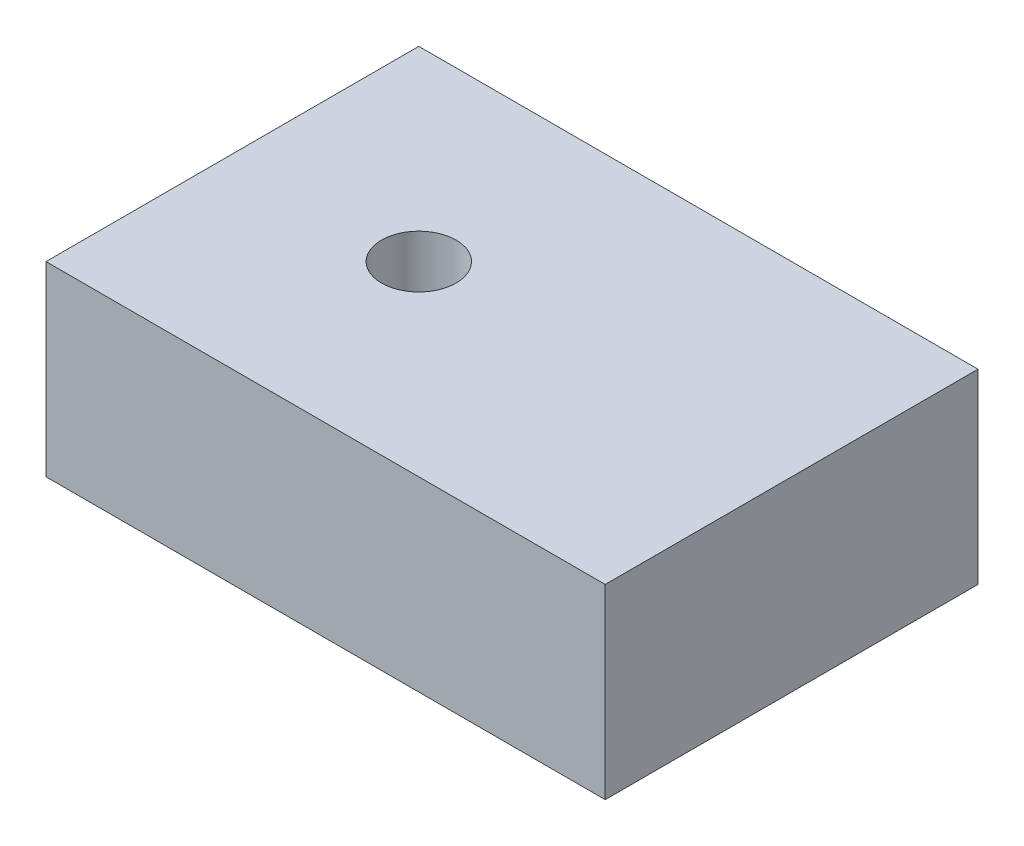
SolidWorks part; units mm, degrees
ref_plane "Vorne" through (0, 0, 0) normal (0, 0, 1) x (1, 0, 0)
ref_plane "Oben" through (0, 0, 0) normal (0, 1, 0) x (1, 0, 0)
ref_plane "Rechts" through (0, 0, 0) normal (1, 0, 0) x (0, 0, -1)
sketch "Skizze1" plane through (0, 0, 0) normal (0, 1, 0) x (1, 0, 0)
  line L1 (-30, 20) -> (0, 20)
  line L2 (-30, 20) -> (-30, 0)
  line L3 (-30, 0) -> (0, 0)
  line L4 (0, 20) -> (0, 0)
  dimension "D1" = 20
  dimension "D2" = 30
extrude "Linear austragen1" add sketch "Skizze1" along normal blind 10
sketch "Skizze2" plane through (0, 10, 0) normal (0, 1, 0) x (1, 0, 0)
  line L0 (-30, 20) -> (-30, 0) construction
  circle A0 centre (-20, 10) radius 2
  point P4 (-30, 10)
  dimension "D2" = 4
  dimension "D1" = 10
extrude "Schnitt-Linear austragen1" cut sketch "Skizze2" against normal through all
